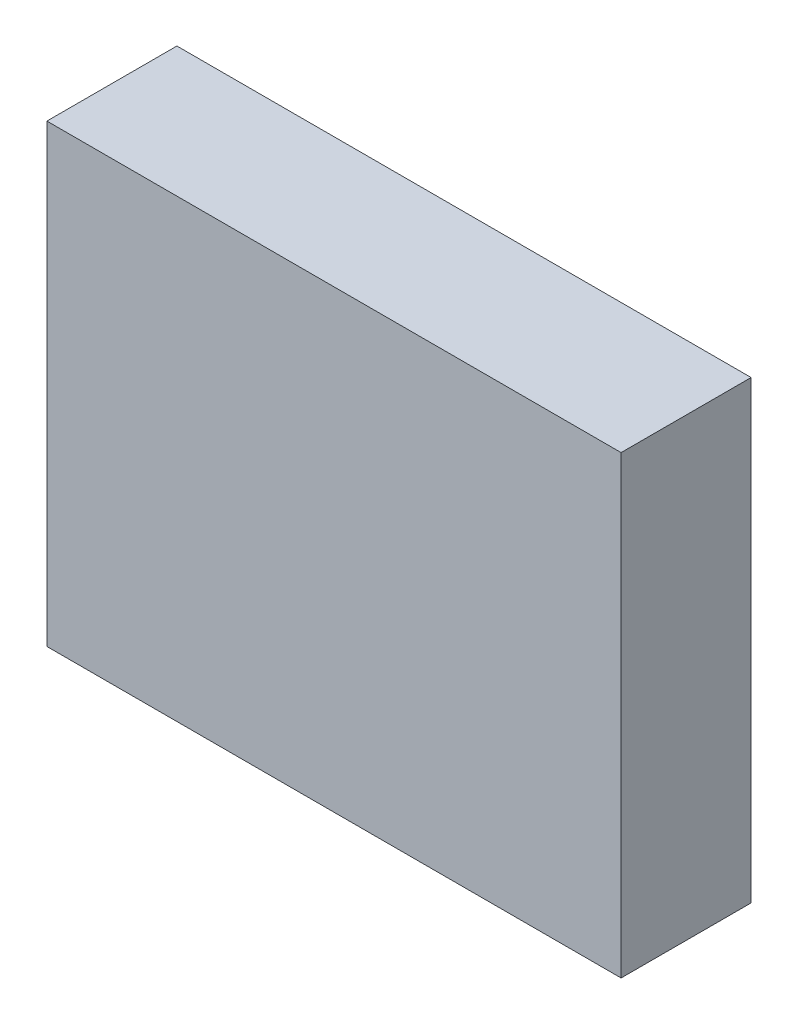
SolidWorks part; units mm, degrees
ref_plane "Front Plane" through (0, 0, 0) normal (0, 0, 1) x (1, 0, 0)
ref_plane "Top Plane" through (0, 0, 0) normal (0, 1, 0) x (1, 0, 0)
ref_plane "Right Plane" through (0, 0, 0) normal (1, 0, 0) x (0, 0, -1)
sketch "Sketch1" plane through (0, 0, 0) normal (0, 0, 1) x (1, 0, 0)
  line L1 (-62.0515, 29.768) -> (43.9485, 29.768)
  line L2 (-62.0515, 29.768) -> (-62.0515, -54.232)
  line L3 (-62.0515, -54.232) -> (43.9485, -54.232)
  line L4 (43.9485, 29.768) -> (43.9485, -54.232)
  dimension "D1" = 106
  dimension "D2" = 84
extrude "Boss-Extrude1" add sketch "Sketch1" along normal blind 24
sketch "Sketch2" plane through (0, 0, 24) normal (0, 0, 1) x (1, 0, 0)
  text T0 "EPOS2 P24/5 Controller"
